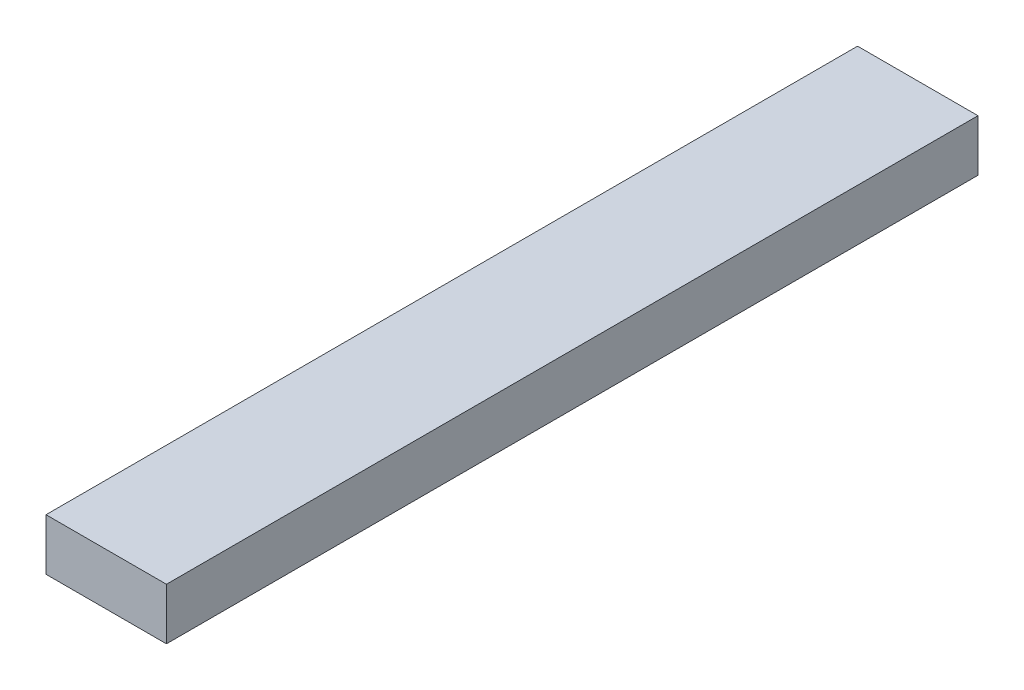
SolidWorks part; units mm, degrees
ref_plane "Front Plane" through (0, 0, 0) normal (0, 0, 1) x (1, 0, 0)
ref_plane "Top Plane" through (0, 0, 0) normal (0, 1, 0) x (1, 0, 0)
ref_plane "Right Plane" through (0, 0, 0) normal (1, 0, 0) x (0, 0, -1)
sketch "Sketch1" plane through (0, 0, 0) normal (0, 0, 1) x (1, 0, 0)
  line L1 (21, -9) -> (-21, -9)
  line L2 (21, -9) -> (21, 9)
  line L3 (21, 9) -> (-21, 9)
  line L4 (-21, -9) -> (-21, 9)
  line L5 (21, -9) -> (-21, 9) construction
  line L6 (21, 9) -> (-21, -9) construction
  point P0 (0, 0)
  dimension "D1" = 42
  dimension "D2" = 18
extrude "Boss-Extrude1" add sketch "Sketch1" along normal blind 283
